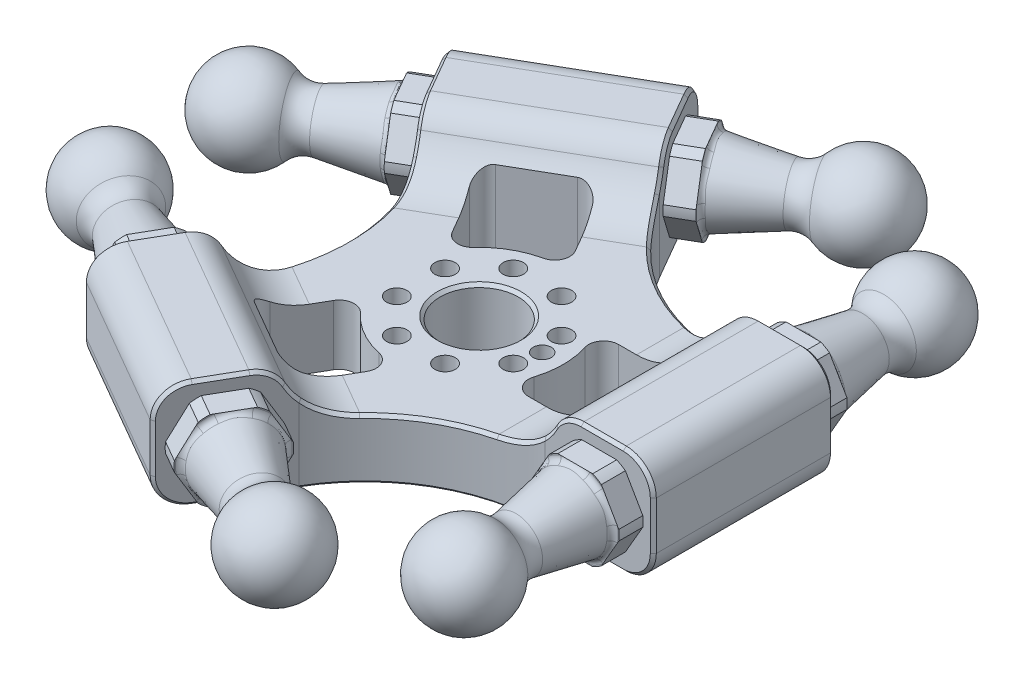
SolidWorks part; units mm, degrees
ref_plane "前视基准面" through (0, 0, 0) normal (0, 0, 1) x (1, 0, 0)
ref_plane "上视基准面" through (0, 0, 0) normal (0, 1, 0) x (1, 0, 0)
ref_plane "右视基准面" through (0, 0, 0) normal (1, 0, 0) x (0, 0, -1)
imported_body "solid1"
sketch "草图1" plane through (0, 0, 0) normal (0, -1, 0) x (1, 0, 0)
  circle A0 centre (0, 0) radius 13 construction
  circle A1 centre (0, 0) radius 28
  circle A2 centre (0, 0) radius 28
  circle A3 centre (8.0364, -19.4015) radius 3.4 construction
  circle A4 centre (-8.0364, -19.4015) radius 3.4 construction
  circle A5 centre (-19.4015, -8.0364) radius 3.4 construction
  circle A6 centre (-19.4015, 8.0364) radius 3.4 construction
  circle A7 centre (-8.0364, 19.4015) radius 3.4 construction
  circle A8 centre (8.0364, 19.4015) radius 3.4 construction
  circle A9 centre (19.4015, 8.0364) radius 3.4 construction
  circle A10 centre (21, 0) radius 3 construction
  circle A11 centre (19.4015, -8.0364) radius 3.4 construction
  circle A12 centre (0, 0) radius 13
  circle A13 centre (8.0364, -19.4015) radius 3.4
  circle A14 centre (-8.0364, -19.4015) radius 3.4
  circle A15 centre (-19.4015, -8.0364) radius 3.4
  circle A16 centre (-19.4015, 8.0364) radius 3.4
  circle A17 centre (-8.0364, 19.4015) radius 3.4
  circle A18 centre (8.0364, 19.4015) radius 3.4
  circle A19 centre (19.4015, 8.0364) radius 3.4
  circle A20 centre (21, 0) radius 3
  circle A21 centre (19.4015, -8.0364) radius 3.4
  dimension "D1" = 0
extrude "凸台-拉伸1" add sketch "草图1" along normal blind 5
